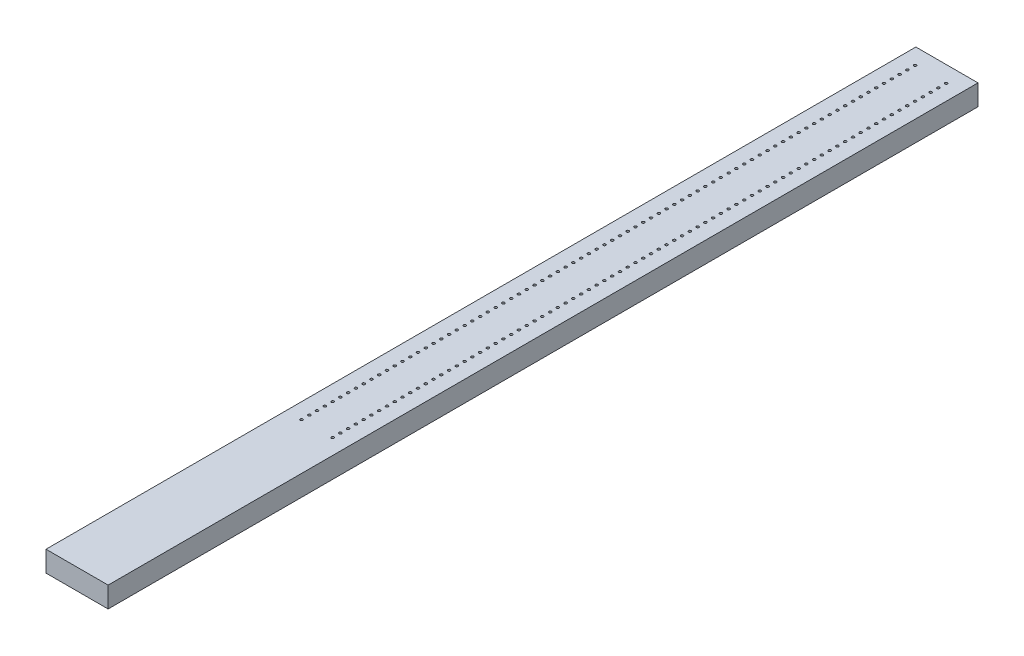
SolidWorks part; units mm, degrees
ref_plane "Front Plane" through (0, 0, 0) normal (0, 0, 1) x (1, 0, 0)
ref_plane "Top Plane" through (0, 0, 0) normal (0, 1, 0) x (1, 0, 0)
ref_plane "Right Plane" through (0, 0, 0) normal (1, 0, 0) x (0, 0, -1)
sketch "Sketch2" plane through (0, 0, 0) normal (0, 0, 1) x (1, 0, 0)
  line L1 (-63.847, -17.3497) -> (88.553, -17.3497)
  line L2 (-63.847, -17.3497) -> (-63.847, 33.4503)
  line L3 (-63.847, 33.4503) -> (88.553, 33.4503)
  line L4 (88.553, -17.3497) -> (88.553, 33.4503)
  dimension "D1" = 152.4
  dimension "D2" = 50.8
extrude "Boss-Extrude1" add sketch "Sketch2" along normal blind 2133.6
sketch "Sketch3" plane through (0, 33.4503, 0) normal (0, 1, 0) x (1, 0, 0)
  line L0 (12.353, 0) -> (12.353, -103.5051) construction
  line L1 (88.553, 0) -> (-63.847, 0) construction
  line L2 (12.353, -39.9989) -> (88.553, -39.9989) construction
  line L3 (88.553, -2133.6) -> (88.553, 0) construction
  line L4 (12.353, -39.9989) -> (-63.847, -39.9989) construction
  line L5 (-63.847, -2133.6) -> (-63.847, 0) construction
  circle A0 centre (-25.747, -39.9989) radius 3.175
  circle A1 centre (50.453, -39.9989) radius 3.175
  circle A2 centre (-25.747, -59.0489) radius 3.175
  circle A3 centre (50.453, -59.0489) radius 3.175
  circle A4 centre (-25.747, -78.0989) radius 3.175
  circle A5 centre (50.453, -78.0989) radius 3.175
  circle A6 centre (-25.747, -97.1489) radius 3.175
  circle A7 centre (50.453, -97.1489) radius 3.175
  circle A8 centre (-25.747, -116.1989) radius 3.175
  circle A9 centre (50.453, -116.1989) radius 3.175
  circle A10 centre (-25.747, -135.2489) radius 3.175
  circle A11 centre (50.453, -135.2489) radius 3.175
  circle A12 centre (-25.747, -154.2989) radius 3.175
  circle A13 centre (50.453, -154.2989) radius 3.175
  circle A14 centre (-25.747, -173.3489) radius 3.175
  circle A15 centre (50.453, -173.3489) radius 3.175
  circle A16 centre (-25.747, -192.3989) radius 3.175
  circle A17 centre (50.453, -192.3989) radius 3.175
  circle A18 centre (-25.747, -211.4489) radius 3.175
  circle A19 centre (50.453, -211.4489) radius 3.175
  circle A20 centre (-25.747, -230.4989) radius 3.175
  circle A21 centre (50.453, -230.4989) radius 3.175
  circle A22 centre (-25.747, -249.5489) radius 3.175
  circle A23 centre (50.453, -249.5489) radius 3.175
  circle A24 centre (-25.747, -268.5989) radius 3.175
  circle A25 centre (50.453, -268.5989) radius 3.175
  circle A26 centre (-25.747, -287.6489) radius 3.175
  circle A27 centre (50.453, -287.6489) radius 3.175
  circle A28 centre (-25.747, -306.6989) radius 3.175
  circle A29 centre (50.453, -306.6989) radius 3.175
  circle A30 centre (-25.747, -325.7489) radius 3.175
  circle A31 centre (50.453, -325.7489) radius 3.175
  circle A32 centre (-25.747, -344.7989) radius 3.175
  circle A33 centre (50.453, -344.7989) radius 3.175
  circle A34 centre (-25.747, -363.8489) radius 3.175
  circle A35 centre (50.453, -363.8489) radius 3.175
  circle A36 centre (-25.747, -382.8989) radius 3.175
  circle A37 centre (50.453, -382.8989) radius 3.175
  circle A38 centre (-25.747, -401.9489) radius 3.175
  circle A39 centre (50.453, -401.9489) radius 3.175
  circle A40 centre (-25.747, -420.9989) radius 3.175
  circle A41 centre (50.453, -420.9989) radius 3.175
  circle A42 centre (-25.747, -440.0489) radius 3.175
  circle A43 centre (50.453, -440.0489) radius 3.175
  circle A44 centre (-25.747, -459.0989) radius 3.175
  circle A45 centre (50.453, -459.0989) radius 3.175
  circle A46 centre (-25.747, -478.1489) radius 3.175
  circle A47 centre (50.453, -478.1489) radius 3.175
  circle A48 centre (-25.747, -497.1989) radius 3.175
  circle A49 centre (50.453, -497.1989) radius 3.175
  circle A50 centre (-25.747, -516.2489) radius 3.175
  circle A51 centre (50.453, -516.2489) radius 3.175
  circle A52 centre (-25.747, -535.2989) radius 3.175
  circle A53 centre (50.453, -535.2989) radius 3.175
  circle A54 centre (-25.747, -554.3489) radius 3.175
  circle A55 centre (50.453, -554.3489) radius 3.175
  circle A56 centre (-25.747, -573.3989) radius 3.175
  circle A57 centre (50.453, -573.3989) radius 3.175
  circle A58 centre (-25.747, -592.4489) radius 3.175
  circle A59 centre (50.453, -592.4489) radius 3.175
  circle A60 centre (-25.747, -611.4989) radius 3.175
  circle A61 centre (50.453, -611.4989) radius 3.175
  circle A62 centre (-25.747, -630.5489) radius 3.175
  circle A63 centre (50.453, -630.5489) radius 3.175
  circle A64 centre (-25.747, -649.5989) radius 3.175
  circle A65 centre (50.453, -649.5989) radius 3.175
  circle A66 centre (-25.747, -668.6489) radius 3.175
  circle A67 centre (50.453, -668.6489) radius 3.175
  circle A68 centre (-25.747, -687.6989) radius 3.175
  circle A69 centre (50.453, -687.6989) radius 3.175
  circle A70 centre (-25.747, -706.7489) radius 3.175
  circle A71 centre (50.453, -706.7489) radius 3.175
  circle A72 centre (-25.747, -725.7989) radius 3.175
  circle A73 centre (50.453, -725.7989) radius 3.175
  circle A74 centre (-25.747, -744.8489) radius 3.175
  circle A75 centre (50.453, -744.8489) radius 3.175
  circle A76 centre (-25.747, -763.8989) radius 3.175
  circle A77 centre (50.453, -763.8989) radius 3.175
  circle A78 centre (-25.747, -782.9489) radius 3.175
  circle A79 centre (50.453, -782.9489) radius 3.175
  circle A80 centre (-25.747, -801.9989) radius 3.175
  circle A81 centre (50.453, -801.9989) radius 3.175
  circle A82 centre (-25.747, -821.0489) radius 3.175
  circle A83 centre (50.453, -821.0489) radius 3.175
  circle A84 centre (-25.747, -840.0989) radius 3.175
  circle A85 centre (50.453, -840.0989) radius 3.175
  circle A86 centre (-25.747, -859.1489) radius 3.175
  circle A87 centre (50.453, -859.1489) radius 3.175
  circle A88 centre (-25.747, -878.1989) radius 3.175
  circle A89 centre (50.453, -878.1989) radius 3.175
  circle A90 centre (-25.747, -897.2489) radius 3.175
  circle A91 centre (50.453, -897.2489) radius 3.175
  circle A92 centre (-25.747, -916.2989) radius 3.175
  circle A93 centre (50.453, -916.2989) radius 3.175
  circle A94 centre (-25.747, -935.3489) radius 3.175
  circle A95 centre (50.453, -935.3489) radius 3.175
  circle A96 centre (-25.747, -954.3989) radius 3.175
  circle A97 centre (50.453, -954.3989) radius 3.175
  circle A98 centre (-25.747, -973.4489) radius 3.175
  circle A99 centre (50.453, -973.4489) radius 3.175
  circle A100 centre (-25.747, -992.4989) radius 3.175
  circle A101 centre (50.453, -992.4989) radius 3.175
  circle A102 centre (-25.747, -1011.5489) radius 3.175
  circle A103 centre (50.453, -1011.5489) radius 3.175
  circle A104 centre (-25.747, -1030.5989) radius 3.175
  circle A105 centre (50.453, -1030.5989) radius 3.175
  circle A106 centre (-25.747, -1049.6489) radius 3.175
  circle A107 centre (50.453, -1049.6489) radius 3.175
  circle A108 centre (-25.747, -1068.6989) radius 3.175
  circle A109 centre (50.453, -1068.6989) radius 3.175
  circle A110 centre (-25.747, -1087.7489) radius 3.175
  circle A111 centre (50.453, -1087.7489) radius 3.175
  circle A112 centre (-25.747, -1106.7989) radius 3.175
  circle A113 centre (50.453, -1106.7989) radius 3.175
  circle A114 centre (-25.747, -1125.8489) radius 3.175
  circle A115 centre (50.453, -1125.8489) radius 3.175
  circle A116 centre (-25.747, -1144.8989) radius 3.175
  circle A117 centre (50.453, -1144.8989) radius 3.175
  circle A118 centre (-25.747, -1163.9489) radius 3.175
  circle A119 centre (50.453, -1163.9489) radius 3.175
  circle A120 centre (-25.747, -1182.9989) radius 3.175
  circle A121 centre (50.453, -1182.9989) radius 3.175
  circle A122 centre (-25.747, -1202.0489) radius 3.175
  circle A123 centre (50.453, -1202.0489) radius 3.175
  circle A124 centre (-25.747, -1221.0989) radius 3.175
  circle A125 centre (50.453, -1221.0989) radius 3.175
  circle A126 centre (-25.747, -1240.1489) radius 3.175
  circle A127 centre (50.453, -1240.1489) radius 3.175
  circle A128 centre (-25.747, -1259.1989) radius 3.175
  circle A129 centre (50.453, -1259.1989) radius 3.175
  circle A130 centre (-25.747, -1278.2489) radius 3.175
  circle A131 centre (50.453, -1278.2489) radius 3.175
  circle A132 centre (-25.747, -1297.2989) radius 3.175
  circle A133 centre (50.453, -1297.2989) radius 3.175
  circle A134 centre (-25.747, -1316.3489) radius 3.175
  circle A135 centre (50.453, -1316.3489) radius 3.175
  circle A136 centre (-25.747, -1335.3989) radius 3.175
  circle A137 centre (50.453, -1335.3989) radius 3.175
  circle A138 centre (-25.747, -1354.4489) radius 3.175
  circle A139 centre (50.453, -1354.4489) radius 3.175
  circle A140 centre (-25.747, -1373.4989) radius 3.175
  circle A141 centre (50.453, -1373.4989) radius 3.175
  circle A142 centre (-25.747, -1392.5489) radius 3.175
  circle A143 centre (50.453, -1392.5489) radius 3.175
  circle A144 centre (-25.747, -1411.5989) radius 3.175
  circle A145 centre (50.453, -1411.5989) radius 3.175
  circle A146 centre (-25.747, -1430.6489) radius 3.175
  circle A147 centre (50.453, -1430.6489) radius 3.175
  circle A148 centre (-25.747, -1449.6989) radius 3.175
  circle A149 centre (50.453, -1449.6989) radius 3.175
  circle A150 centre (-25.747, -1468.7489) radius 3.175
  circle A151 centre (50.453, -1468.7489) radius 3.175
  circle A152 centre (-25.747, -1487.7989) radius 3.175
  circle A153 centre (50.453, -1487.7989) radius 3.175
  circle A154 centre (-25.747, -1506.8489) radius 3.175
  circle A155 centre (50.453, -1506.8489) radius 3.175
  circle A156 centre (-25.747, -1525.8989) radius 3.175
  circle A157 centre (50.453, -1525.8989) radius 3.175
  circle A158 centre (-25.747, -1544.9489) radius 3.175
  circle A159 centre (50.453, -1544.9489) radius 3.175
  dimension "D1" = 6.35
  dimension "D2" = 6.35
  dimension "D3" = 38.1
  dimension "D4" = 38.1
  dimension "D5" = 80
extrude "Cut-Extrude1" cut sketch "Sketch3" against normal blind 19.05
